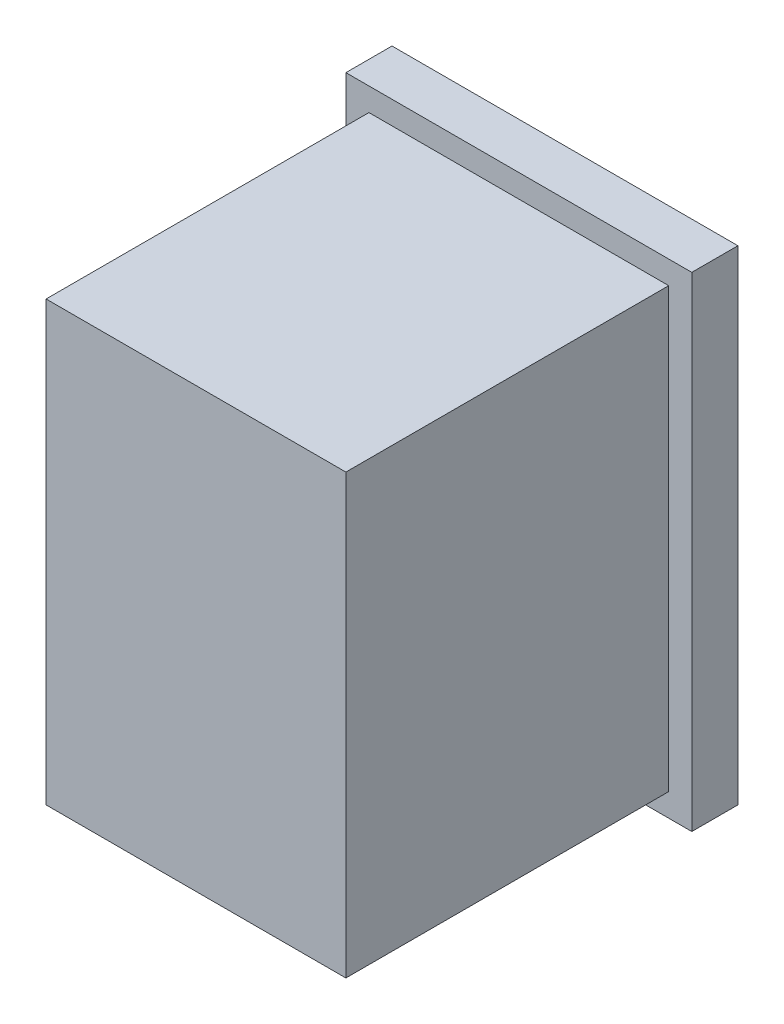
SolidWorks part; units mm, degrees
ref_plane "Спереди" through (0, 0, 0) normal (0, 0, 1) x (1, 0, 0)
ref_plane "Сверху" through (0, 0, 0) normal (0, 1, 0) x (1, 0, 0)
ref_plane "Справа" through (0, 0, 0) normal (1, 0, 0) x (0, 0, -1)
sketch "Эскиз1" plane through (0, 0, 0) normal (0, 0, 1) x (1, 0, 0)
  line L1 (6.5, 9.5) -> (-6.5, 9.5)
  line L2 (6.5, 9.5) -> (6.5, -9.5)
  line L3 (6.5, -9.5) -> (-6.5, -9.5)
  line L4 (-6.5, 9.5) -> (-6.5, -9.5)
extrude "Бобышка-Вытянуть1" add sketch "Эскиз1" along normal blind 14
sketch "Эскиз2" plane through (0, 0, 0) normal (0, 0, -1) x (-1, 0, 0)
  line L1 (-7.5, 10.5) -> (7.5, 10.5)
  line L2 (-7.5, 10.5) -> (-7.5, -10.5)
  line L3 (-7.5, -10.5) -> (7.5, -10.5)
  line L4 (7.5, 10.5) -> (7.5, -10.5)
extrude "Бобышка-Вытянуть2" add sketch "Эскиз2" along normal blind 2
sketch "Эскиз3" plane through (0, 0, -2) normal (0, 0, -1) x (-1, 0, 0)
  line L1 (-5.5, 8) -> (5.5, 8)
  line L2 (-5.5, 8) -> (-5.5, -8)
  line L3 (-5.5, -8) -> (5.5, -8)
  line L4 (5.5, 8) -> (5.5, -8)
extrude "Вырез-Вытянуть1" cut sketch "Эскиз3" against normal blind 13
sketch "Эскиз4" plane through (0, 0, 11) normal (0, 0, -1) x (-1, 0, 0)
  line L1 (-5, 0) -> (5, 0)
  line L2 (-5, 0) -> (-5, -7.5)
  line L3 (-5, -7.5) -> (5, -7.5)
  line L4 (5, 0) -> (5, -7.5)
extrude "Бобышка-Вытянуть3" add sketch "Эскиз4" along normal blind 13.5
